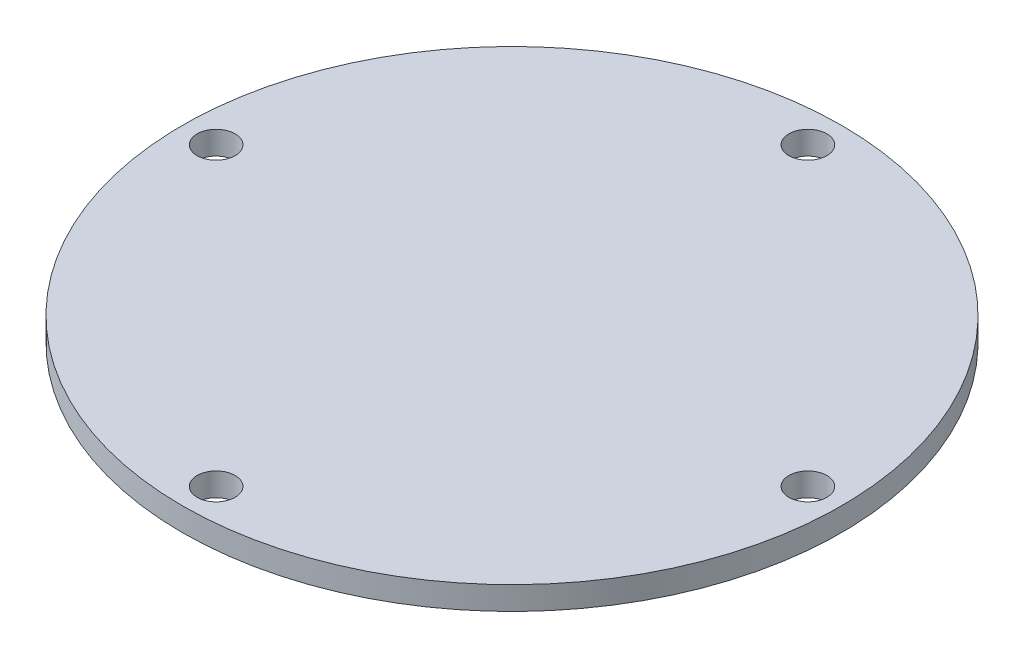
SolidWorks part; units mm, degrees
ref_plane "Front Plane" through (0, 0, 0) normal (0, 0, 1) x (1, 0, 0)
ref_plane "Top Plane" through (0, 0, 0) normal (0, 1, 0) x (1, 0, 0)
ref_plane "Right Plane" through (0, 0, 0) normal (1, 0, 0) x (0, 0, -1)
sketch "Sketch1" plane through (0, 0, 0) normal (0, 1, 0) x (1, 0, 0)
  circle A0 centre (0, 0) radius 45
extrude "Boss-Extrude1" add sketch "Sketch1" along normal blind 3.175
sketch "Sketch2" plane through (0, 3.175, 0) normal (0, 1, 0) x (1, 0, 0)
  circle A0 centre (0, 0) radius 36
hole_wizard "#6 (0.204) Diameter Hole1" positions "Sketch4" profile "Sketch3" hole size "#6" standard "ANSI Inch"
sketch "Sketch4" plane through (0, 3.175, 0) normal (0, 1, 0) x (1, 0, 0)
  point P0 (40.4, 0)
sketch "Sketch3" plane through (40.4, 3.175, 0) normal (1, 0, 0) x (0, 0, 1)
  line L0 (0, 0) -> (0, 41.5567)
  line L1 (0, 41.5567) -> (2.5908, 40)
  line L2 (2.5908, 40) -> (2.5908, 0)
  line L5 (2.5908, 0) -> (0, 0)
  line L10 (0, 41.5567) -> (-2.5908, 40) construction
  line L11 (0, -6.35) -> (0, 107.95) construction
  dimension "Hole Dia." = 5.1816
  dimension "Hole Depth" = 40
  dimension "Drill Angle" = 118
pattern_circular "CirPattern1" count 4 over 360 about axis through (0, 0, 0) along (0, 1, 0) of "#6 (0.204) Diameter Hole1"
